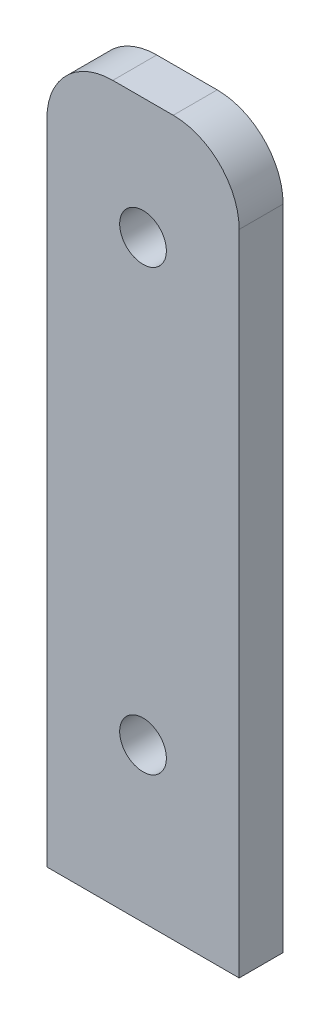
SolidWorks part; units mm, degrees
ref_plane "Plan_Face" through (0, 0, 0) normal (0, 0, 1) x (1, 0, 0)
ref_plane "Plan_Dessus" through (0, 0, 0) normal (0, 1, 0) x (1, 0, 0)
ref_plane "Plan_Droite" through (0, 0, 0) normal (1, 0, 0) x (0, 0, -1)
sketch "Esquisse1" plane through (0, 0, 0) normal (0, 0, 1) x (1, 0, 0)
  line L2 (-17.5, 0) -> (17.5, 0)
  line L3 (-17.5, 0) -> (-17.5, 130)
  line L4 (-17.5, 130) -> (17.5, 130)
  line L5 (17.5, 0) -> (17.5, 130)
  dimension "D1" = 130
  dimension "D2" = 35
extrude "Extrusion1" add sketch "Esquisse1" along normal mid plane 8
fillet "Congé1" radius 12 2 edges at (-17.5, 130, 0) (17.5, 130, 0)
hole_wizard "Trou taraudé M101" positions "Esquisse3D1" profile "Esquisse2" tap size "M10" standard "ISO"
sketch3d "Esquisse3D1"
  line L0 (-17.5, 118, 4) -> (-17.5, 0, 4) construction
  line L1 (-17.5, 0, 4) -> (17.5, 0, 4) construction
  point P0 (0, 28, 4)
  point P2 (0, 108, 4)
  dimension "D1" = 17.5
  dimension "D2" = 28
  dimension "D3" = 80
sketch "Esquisse2" plane through (0, 28, 4) normal (1, 0, 0) x (0, -1, 0)
  line L0 (0, 0) -> (0, 8)
  line L1 (0, 8) -> (4.25, 8)
  line L2 (4.25, 8) -> (4.25, 0)
  line L5 (4.25, 0) -> (0, 0)
  line L11 (0, -6.35) -> (0, 107.95) construction
  dimension "Diamètre du trou pour taraudage jusqu'au prochain" = 8.5
  dimension "Profondeur du trou pour taraudage jusqu'au prochain" = 8
